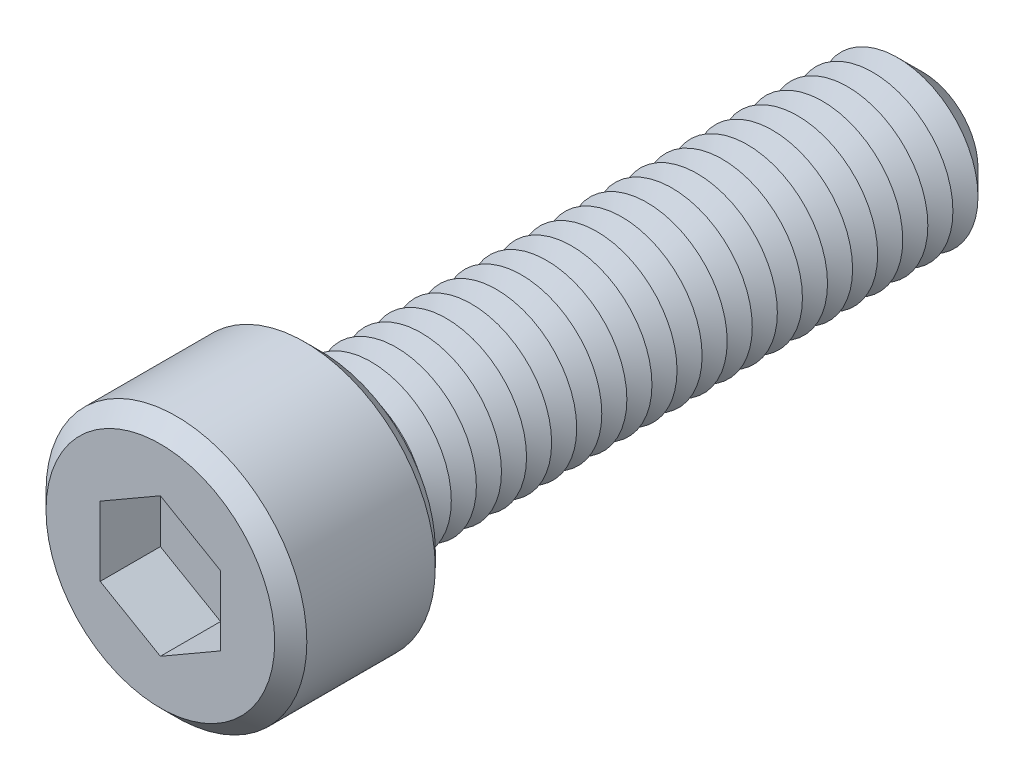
SolidWorks part; units mm, degrees
ref_plane "Front Plane" through (0, 0, 0) normal (0, 0, 1) x (1, 0, 0)
ref_plane "Top Plane" through (0, 0, 0) normal (0, 1, 0) x (1, 0, 0)
ref_plane "Right Plane" through (0, 0, 0) normal (1, 0, 0) x (0, 0, -1)
sketch "Sketch1" plane through (0, 0, 0) normal (0, 0, 1) x (1, 0, 0)
  circle A0 centre (0, 0) radius 6.5
  dimension "D1" = 13
extrude "Boss-Extrude1" add sketch "Sketch1" along normal blind 8
sketch "Sketch2" plane through (0, 0, 0) normal (0, 0, -1) x (-1, 0, 0)
  circle A0 centre (0, 0) radius 4
  dimension "D1" = 8
extrude "Boss-Extrude2" add sketch "Sketch2" along normal blind 30
chamfer "Chamfer1" distance 1.25 angle 45 1 edges at (-4, 0, -30)
sketch "Sketch3" plane through (0, 0, 0) normal (1, 0, 0) x (0, 0, -1)
  line L0 (-2.5121, 0) -> (4.5776, 0) construction
sketch "Sketch4" plane through (0, 0, 0) normal (1, 0, 0) x (0, 0, -1)
  line L0 (0, 4) -> (0.625, 2.9175)
  line L1 (0.625, 2.9175) -> (1.25, 4)
  line L2 (28.75, 4) -> (0, 4) construction
  line L3 (1.25, 4) -> (0, 4)
  dimension "D1" = 1.25
revolve "Cut-Revolve1" cut sketch "Sketch4" angle 360 about L0
pattern_linear "LPattern1" count 23 spacing 1.25 along (0, 0, -1) of "Cut-Revolve1"
sketch "Sketch5" plane through (0, 0, 8) normal (0, 0, 1) x (1, 0, 0)
  line L1 (0, 3.4641) -> (-3, 1.7321)
  line L2 (-3, 1.7321) -> (-3, -1.7321)
  line L3 (-3, -1.7321) -> (0, -3.4641)
  line L4 (0, -3.4641) -> (3, -1.7321)
  line L5 (3, -1.7321) -> (3, 1.7321)
  line L6 (3, 1.7321) -> (0, 3.4641)
  circle A0 centre (0, 0) radius 3 construction
  dimension "D1" = 6
extrude "Cut-Extrude1" cut sketch "Sketch5" against normal blind 3
sketch "Sketch6" plane through (0, 0, 5) normal (0, 0, 1) x (1, 0, 0)
  circle A0 centre (0, 0) radius 0.9
  dimension "D1" = 1.8
extrude "Cut-Extrude2" cut sketch "Sketch6" against normal up to surface (35 mm away)
chamfer "Chamfer2" distance 0.8 angle 45 2 edges at (6.5, 0, 0) (6.5, 0, 8)
